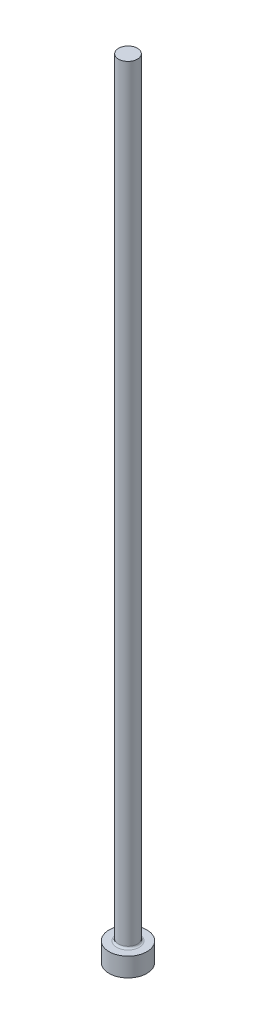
SolidWorks part; units mm, degrees
ref_plane "Plano frontal" through (0, 0, 0) normal (0, 0, 1) x (1, 0, 0)
ref_plane "Plano superior" through (0, 0, 0) normal (0, 1, 0) x (1, 0, 0)
ref_plane "Plano direito" through (0, 0, 0) normal (1, 0, 0) x (0, 0, -1)
sketch "Esboço1" plane through (0, 0, 0) normal (0, 0, 1) x (1, 0, 0)
  line L0 (0, 0) -> (3, 0)
  line L1 (3, 0) -> (3, 3)
  line L2 (3, 3) -> (1.8, 3)
  line L3 (1.5, 3.3) -> (1.5, 125)
  line L4 (1.5, 125) -> (0, 125)
  line L5 (0, 125) -> (0, 0) construction
  line L6 (0, 0) -> (0, 125)
  arc A0 (1.8, 3) -> (1.5, 3.3) centre (1.8, 3.3) cw
  dimension "D3" = 0.3
  dimension "D1" = 6
  dimension "D2" = 3
  dimension "D4" = 3
  dimension "D5" = 125
revolve "Revolução1" add sketch "Esboço1" angle 360 about L5
sketch "Esboço2"
  dimension "D1" = 1.6125
  dimension "D2" = 0.3375
  dimension "D3" = 0.525
  dimension "D4" = 0.225
wrap "Envolver1" sketch "Esboço2" wrap type deboss source sketch "Esboço2" thickness 0.1 parameters "D1"=0.1
